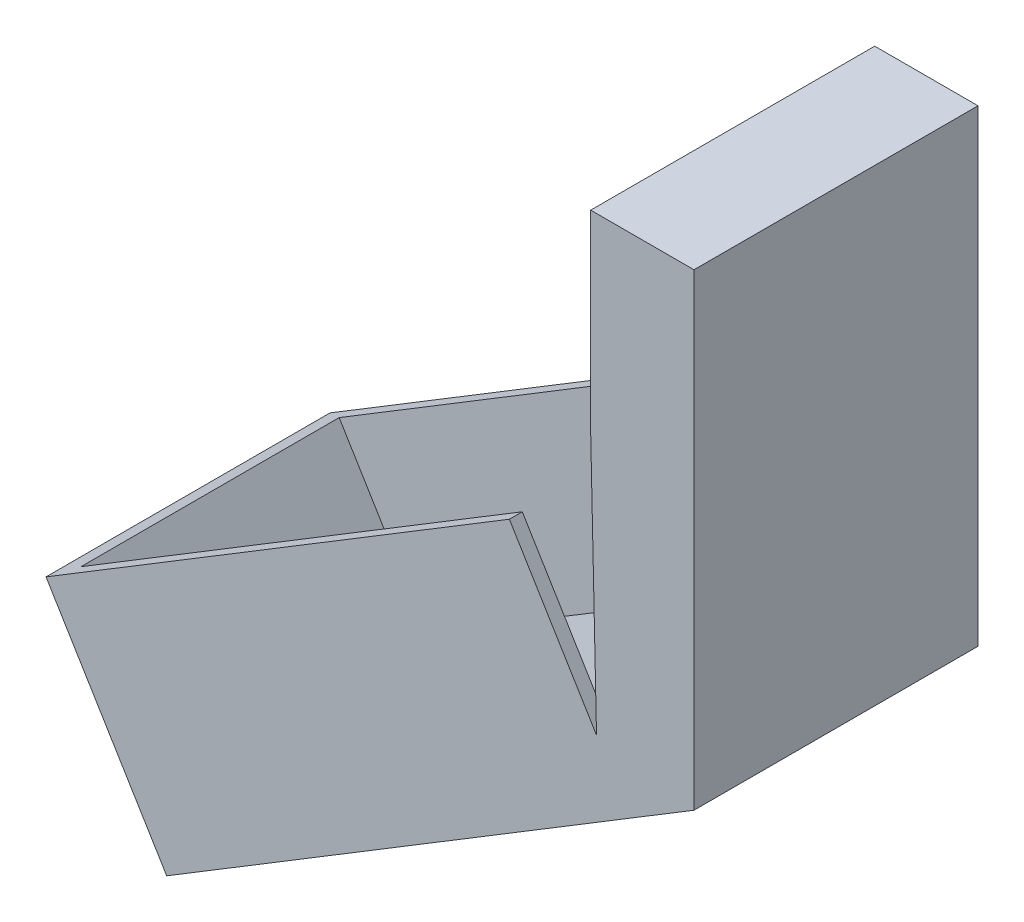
SolidWorks part; units mm, degrees
ref_plane "Front Plane" through (0, 0, 0) normal (0, 0, 1) x (1, 0, 0)
ref_plane "Top Plane" through (0, 0, 0) normal (0, 1, 0) x (1, 0, 0)
ref_plane "Right Plane" through (0, 0, 0) normal (1, 0, 0) x (0, 0, -1)
sketch "Sketch1" plane through (0, 0, 0) normal (0, 0, 1) x (1, 0, 0)
  line L0 (0, 0) -> (0.4497, -19.9949)
  line L1 (0.4497, -19.9949) -> (-33.7328, -40.7688)
  line L2 (-33.7328, -40.7688) -> (-35.2909, -38.2051)
  line L3 (-35.2909, -38.2051) -> (-37, -39.2438)
  line L4 (-37, -39.2438) -> (-32.8452, -46.0803)
  line L5 (-32.8452, -46.0803) -> (8, -21.2573)
  line L6 (8, -21.2573) -> (8, 0)
  line L7 (8, 0) -> (0, 0)
  dimension "D1" = 40
  dimension "D2" = 20
  dimension "D3" = 3
  dimension "D4" = 8
  dimension "D5" = 2
  dimension "D6" = 8
  dimension "D7" = 120
  dimension "D8" = 45
extrude "Boss-Extrude1" add sketch "Sketch1" along normal blind 22
sketch "Sketch2" plane through (0, 0, 0) normal (0, 1, 0) x (1, 0, 0)
  line L1 (0, 0) -> (8, 0)
  line L2 (0, 0) -> (0, -22)
  line L3 (0, -22) -> (8, -22)
  line L4 (8, 0) -> (8, -22)
extrude "Boss-Extrude2" add sketch "Sketch2" along normal blind 15
sketch "Sketch3" plane through (7.4373, -12.2378, 0) normal (-0.5193, 0.8546, 0) x (0.8546, 0.5193, 0)
  line L1 (-50, 0) -> (-52, 0)
  line L2 (-50, 0) -> (-50, -22)
  line L3 (-50, -22) -> (-52, -22)
  line L4 (-52, 0) -> (-52, -22)
extrude "Boss-Extrude3" add sketch "Sketch3" along normal blind 10
sketch "Sketch4" plane through (8.9953, -14.8015, 0) normal (-0.5193, 0.8546, 0) x (0.8546, 0.5193, 0)
  line L0 (-50, -22) -> (-50, 0) construction
  line L1 (-10, 0) -> (-50, 0)
  line L2 (-10, 0) -> (-10, -1)
  line L3 (-10, -1) -> (-50, -1)
  line L4 (-50, 0) -> (-50, -1)
  line L5 (-10, -22) -> (-10, 0) construction
  line L6 (-50, -22) -> (-10, -22)
  line L7 (-50, -22) -> (-50, -21)
  line L8 (-50, -21) -> (-10, -21)
  line L9 (-10, -22) -> (-10, -21)
  dimension "D1" = 1
  dimension "D2" = 1
extrude "Boss-Extrude4" add sketch "Sketch4" along normal blind 13
